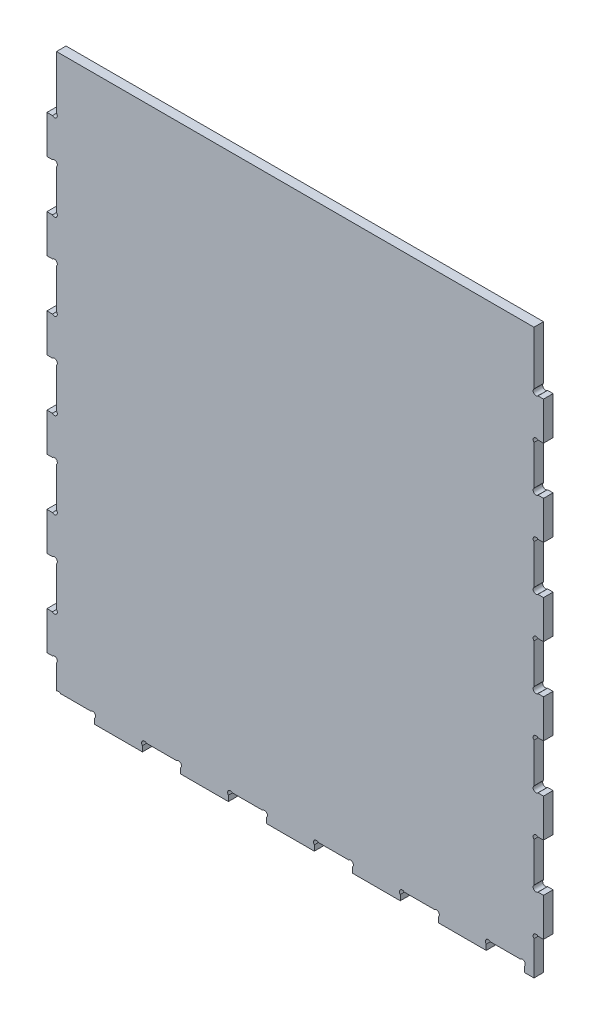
SolidWorks part; units mm, degrees
ref_plane "Alzado" through (0, 0, 0) normal (0, 0, 1) x (1, 0, 0)
ref_plane "Planta" through (0, 0, 0) normal (0, 1, 0) x (1, 0, 0)
ref_plane "Vista lateral" through (0, 0, 0) normal (1, 0, 0) x (0, 0, -1)
sketch "Croquis1" plane through (510, 0, 0) normal (-1, 0, 0) x (0, 0, 1)
  line L0 (-10, 590.2138) -> (0, 590.2138)
  line L1 (-10, 590.2138) -> (-10, 0)
  line L2 (0, 590.2138) -> (0, 0)
  line L3 (-10, 0) -> (0, 0)
  dimension "D1" = 10
extrude "Saliente-Extruir1" add sketch "Croquis1" along normal up to surface (500 mm away)
sketch "Croquis2" plane through (0, 0, 0) normal (0, 0, 1) x (1, 0, 0)
  line L0 (10, 0) -> (10, 590.2138) construction
  line L1 (10, 40) -> (0, 40)
  line L2 (10, 40) -> (10, 80)
  line L3 (10, 80) -> (0, 80)
  line L4 (0, 40) -> (0, 80)
  line L5 (10, 0) -> (510, 0) construction
  dimension "D1" = 40
  dimension "D2" = 10
  dimension "D3" = 40
extrude "Saliente-Extruir2" add sketch "Croquis2" against normal blind 10
sketch "Croquis3" plane through (0, 0, 0) normal (0, 0, 1) x (1, 0, 0)
  line L0 (7.8787, 37.8787) -> (7.8787, 40) construction
  line L1 (0, 40) -> (10, 40) construction
  line L2 (7.8787, 37.8787) -> (10, 37.8787) construction
  line L3 (10, 0) -> (10, 40) construction
  line L4 (0, 60) -> (29.9599, 60) construction
  line L5 (0, 80) -> (0, 40) construction
  line L6 (7.8787, 82.1213) -> (10, 82.1213) construction
  line L7 (7.8787, 82.1213) -> (7.8787, 80) construction
  circle A0 centre (7.8787, 37.8787) radius 3
  circle A1 centre (7.8787, 82.1213) radius 3
  point P13 (0, 60)
  dimension "D1" = 6
extrude "Cortar-Extruir1" cut sketch "Croquis3" against normal through all both and the other way through all
pattern_linear "MatrizL1" count 6 spacing 90 along (0, 1, 0) of "Cortar-Extruir1", "Saliente-Extruir2"
ref_plane "Plano1" through (260, 0, 0) normal (-1, 0, 0) x (0, 0, 1)
mirror "Simetría1" about plane through (260, 0, 0) normal (-1, 0, 0) of "MatrizL1", "Saliente-Extruir2", "Cortar-Extruir1"
sketch "Croquis4" plane through (0, 0, 0) normal (0, 0, 1) x (1, 0, 0)
  line L0 (10, 0) -> (510, 0) construction
  line L1 (10, 10) -> (50, 10)
  line L2 (10, 10) -> (10, 0)
  line L3 (10, 0) -> (50, 0)
  line L4 (50, 10) -> (50, 0)
  line L6 (10, 0) -> (10, 35.7574) construction
  dimension "D1" = 40
  dimension "D2" = 10
extrude "Cortar-Extruir2" cut sketch "Croquis4" against normal blind 10
sketch "Croquis5" plane through (0, 0, 0) normal (0, 0, 1) x (1, 0, 0)
  line L0 (47.8787, 7.8787) -> (47.8787, 10) construction
  line L1 (50, 10) -> (10, 10) construction
  line L2 (47.8787, 7.8787) -> (50, 7.8787) construction
  line L3 (50, 0) -> (50, 10) construction
  line L4 (30, 10) -> (30, 1.0941) construction
  line L5 (12.1213, 7.8787) -> (10, 7.8787) construction
  line L6 (12.1213, 7.8787) -> (12.1213, 10) construction
  circle A0 centre (47.8787, 7.8787) radius 3
  circle A1 centre (12.1213, 7.8787) radius 3
  point P11 (30, 10)
  dimension "D1" = 6
extrude "Cortar-Extruir3" cut sketch "Croquis5" against normal through all both and the other way through all
pattern_linear "MatrizL2" count 6 spacing 90 along (1, 0, 0) of "Cortar-Extruir3", "Cortar-Extruir2"
